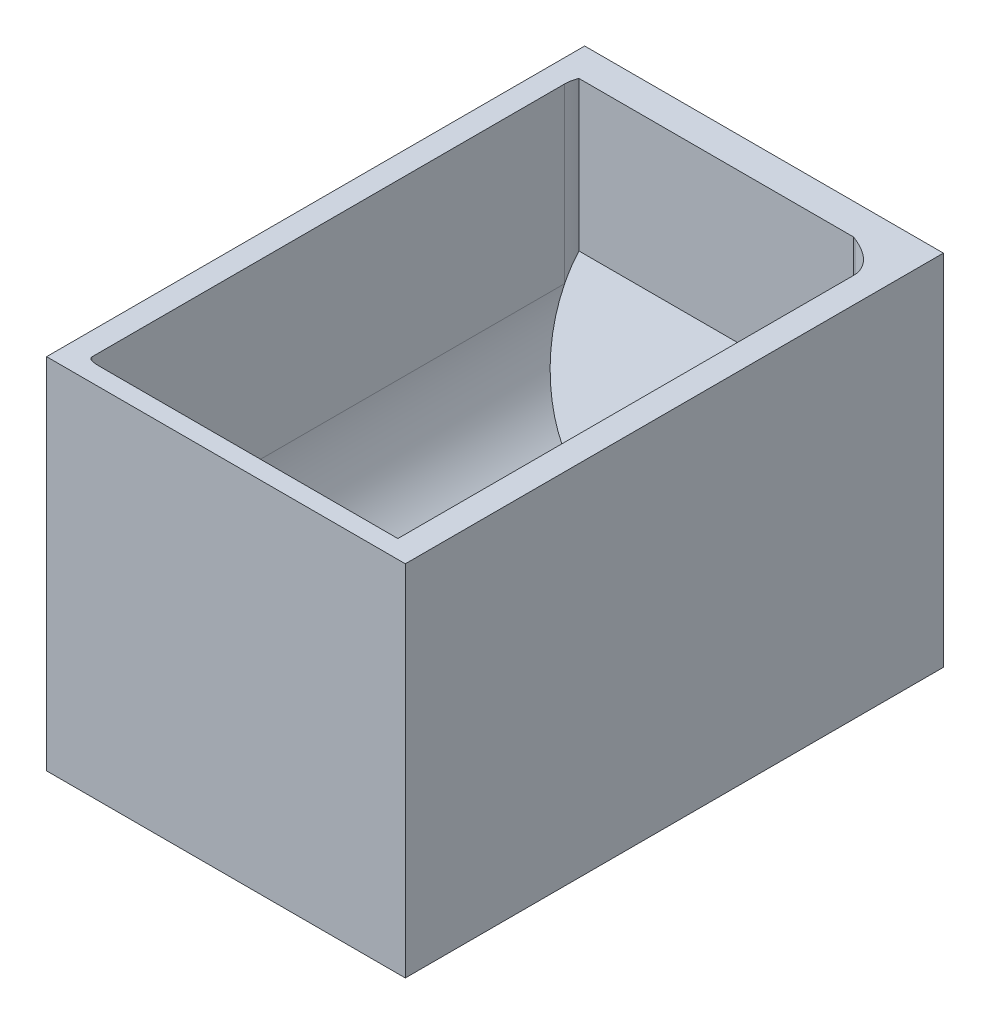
SolidWorks part; units mm, degrees
ref_plane "Ebene vorne" through (0, 0, 0) normal (0, 0, 1) x (1, 0, 0)
ref_plane "Ebene oben" through (0, 0, 0) normal (0, 1, 0) x (1, 0, 0)
ref_plane "Ebene rechts" through (0, 0, 0) normal (1, 0, 0) x (0, 0, -1)
sketch "Skizze1" plane through (0, 0, 0) normal (0, 0, 1) x (1, 0, 0)
  line L1 (-50, -50) -> (50, -50)
  line L2 (-50, -50) -> (-50, 50)
  line L3 (-50, 50) -> (50, 50)
  line L4 (50, -50) -> (50, 50)
  line L5 (-50, -50) -> (50, 50) construction
  line L6 (-50, 50) -> (50, -50) construction
  point P0 (0, 0)
  dimension "D1" = 100
  dimension "D2" = 100
extrude "Aufsatz-Linear austragen1" add sketch "Skizze1" along normal mid plane 150
sketch "Skizze2" plane through (0, 0, 0) normal (0, 0, -1) x (-1, 0, 0)
  line L0 (11.0267, -31.5997) -> (-19.8886, -32.3272)
  line L1 (-29.2027, 35.1778) -> (10.2411, 35.1778)
  arc A0 (10.2411, 35.1778) -> (11.0267, -31.5997) centre (10.2411, 1.7844) cw
  arc A1 (-19.8886, -32.3272) -> (-34.2276, 7.8188) centre (-20.4167, -9.8821) cw
  arc A2 (-34.2276, 7.8188) -> (-29.2027, 35.1778) centre (-47.1063, 24.3251) ccw
  point P8 (34.4361, -25.4617)
  point P9 (-33.8382, -31.1489)
  point P10 (-33.8382, 38.4179)
  point P11 (-38.8216, 24.9308)
  point P12 (-45.135, 10.4681)
  point P13 (-25.8906, -9.4883)
  point P14 (12.5227, 1.8035)
  point P15 (-34.2276, 7.8188)
sketch "Skizze3" plane through (0, 0, 0) normal (1, 0, 0) x (0, 0, -1)
  line L0 (31.6223, 62.4886) -> (66.3725, 8.3438)
  line L1 (66.3725, 8.3438) -> (24.1474, -74.9136)
  arc A0 (-26.3833, 62.4886) -> (-45.6703, -73.4053) centre (17.273, -13.023) ccw
surface "Oberfläche-Linear austragen1" sketch "Skizze3"
extrude "Aufsatz-Linear austragen2" add sketch "Skizze2" against normal up to surface and the other way up to surface separate body
delete or keep bodies "Körper-Löschen/beibehalten 1" type delete bodies bodies 105 106
combine bodies "Kombinieren1" operation type subtract main body 102 bodies to subtract 107
other "Trennfuge2"
sketch3d "3D-Skizze2"
  line L0 (-43.6345, 1.7844, 68.6841) -> (-43.6345, 1.7844, -63.0458) construction
  line L1 (-42.9839, 8.3438, -66.3725) -> (33.5816, 8.3438, -66.3725) construction
  line L2 (42.8681, -9.8821, -57.129) -> (42.8681, -9.8821, 69.8936) construction
  line L3 (42.6473, -13.023, 69.9501) -> (-40.1719, -13.023, 69.9501) construction
  line L4 (-43.6345, 1.7844, 68.6841) -> (-43.6345, 1.7844, -63.0458)
  line L5 (-42.9839, 8.3438, -66.3725) -> (33.5816, 8.3438, -66.3725)
  line L6 (42.8681, -9.8821, -57.129) -> (42.8681, -9.8821, 69.8936)
  line L7 (42.6473, -13.023, 69.9501) -> (-40.1719, -13.023, 69.9501)
  spline S0 degree 3 poles (1577.0959, 302.4106, 2467.198) (684.0041, 1.7632, -193.6053) (-14.0177, -128.9967, 79.8834) (-42.9076, -5.1751, 69.5987) (-43.0364, -4.5398, 69.539) (-43.2554, -3.274, 69.4059) (-43.346, -2.6413, 69.3324) (-62.9655, 168.9625, 47.4879) (1253.5032, 327.1181, -487.3788) (-204.9722, 105.6336, -2608.048) knots -24.020926 -24.020926 -24.020926 -24.020926 0.5 0.5 0.625 0.625 0.75 0.75 34.535158 34.535158 34.535158 34.535158 only from (-40.1719, -13.023, 69.9501) to (-43.6345, 1.7844, 68.6841) construction
  spline S1 degree 3 poles (-43.6345, 1.7844, -63.0458) (-43.6345, 3.9888, -64.1638) (-43.4169, 6.1824, -65.2763) (-42.9839, 8.3438, -66.3725) knots 0 0 0 0 1 1 1 1 weights 1 0.996745 0.996745 1 construction
  spline S2 degree 3 poles (33.5816, 8.3438, -66.3725) (33.7934, 8.1645, -66.2816) (34.0088, 7.9895, -66.1928) (34.2276, 7.8188, -66.1062) knots 0 0 0 0 1 1 1 1 weights 1 0.999868 0.999868 1 construction
  spline S3 degree 3 poles (34.2276, 7.8188, -66.1062) (39.7792, 3.4872, -63.9094) (42.8681, -2.8406, -60.7002) (42.8681, -9.8821, -57.129) knots 0 0 0 0 1 1 1 1 weights 1 0.932434 0.932434 1 construction
  spline S4 degree 3 poles (2956.8416, 553.4749, 160.5451) (-1092.9331, 167.9848, -227.202) (51.9654, 119.2544, 67.5789) (40.2816, -47.6053, 70.588) (-52.3197, -99.7908, 48.7653) (61.766, 2984.4441, 2.2422) knots -124.204594 -124.204594 -124.204594 -124.204594 0.5 0.5 34.995215 34.995215 34.995215 34.995215 only from (42.8681, -9.8821, 69.8936) to (42.6473, -13.023, 69.9501) construction
  spline S5 degree 3 poles (-40.1719, -13.023, 69.9501) (-41.3106, -10.7215, 69.9501) (-42.1749, -8.3151, 69.8595) (-42.9076, -5.1751, 69.5987) (-43.0364, -4.5398, 69.539) (-43.2554, -3.274, 69.4059) (-43.346, -2.6413, 69.3324) (-43.563, -0.7436, 69.0909) (-43.6345, 0.5208, 68.9017) (-43.6345, 1.7844, 68.6841) knots 0 0 0 0 0.5 0.5 0.625 0.625 0.75 0.75 1 1 1 1
  spline S6 degree 3 poles (-43.6345, 1.7844, -63.0458) (-43.6345, 3.9888, -64.1638) (-43.4169, 6.1824, -65.2763) (-42.9839, 8.3438, -66.3725) knots 0 0 0 0 1 1 1 1 weights 1 0.996745 0.996745 1
  spline S7 degree 3 poles (33.5816, 8.3438, -66.3725) (33.7934, 8.1645, -66.2816) (34.0088, 7.9895, -66.1928) (34.2276, 7.8188, -66.1062) knots 0 0 0 0 1 1 1 1 weights 1 0.999868 0.999868 1
  spline S8 degree 3 poles (34.2276, 7.8188, -66.1062) (39.7792, 3.4872, -63.9094) (42.8681, -2.8406, -60.7002) (42.8681, -9.8821, -57.129) knots 0 0 0 0 1 1 1 1 weights 1 0.932434 0.932434 1
  spline S9 degree 3 poles (42.8681, -9.8821, 69.8936) (42.8681, -10.4036, 69.9124) (42.8499, -10.9263, 69.9265) (42.7765, -11.9744, 69.9454) (42.7209, -12.5019, 69.9501) (42.6473, -13.023, 69.9501) knots 0 0 0 0 0.5 0.5 1 1 1 1
surface "Oberfläche-Linear austragen2" sketch "3D-Skizze2" parameters "D1"=10
split "Abspalten1" trimming surface bodies 112 bodies to split 109 resulting bodies 113
delete or keep bodies "Körper-Löschen/beibehalten 2" type delete bodies bodies 110 111 112
